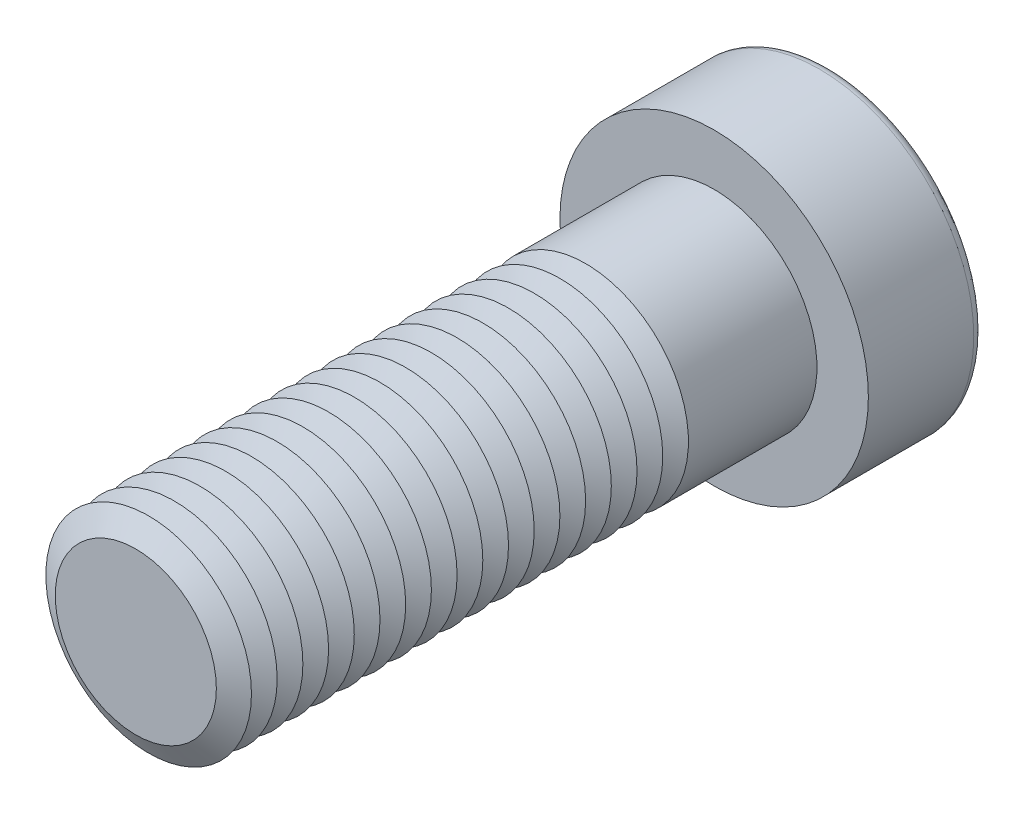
SolidWorks part; units mm, degrees
ref_plane "Front Plane" through (0, 0, 0) normal (0, 0, 1) x (1, 0, 0)
ref_plane "Top Plane" through (0, 0, 0) normal (0, 1, 0) x (1, 0, 0)
ref_plane "Right Plane" through (0, 0, 0) normal (1, 0, 0) x (0, 0, -1)
sketch "Sketch1" plane through (0, 0, 0) normal (0, 0, 1) x (1, 0, 0)
  circle A0 centre (0, 0) radius 8
  dimension "D1" = 16
extrude "Boss-Extrude1" add sketch "Sketch1" along normal blind 45
sketch "Sketch2" plane through (0, 0, 0) normal (0, 0, -1) x (-1, 0, 0)
  circle A0 centre (0, 0) radius 12
  dimension "D1" = 24
extrude "Boss-Extrude2" add sketch "Sketch2" along normal blind 9
sketch "Sketch3" plane through (0, 0, -9) normal (0, 0, -1) x (-1, 0, 0)
  line L1 (-3.4641, 6) -> (-6.9282, 0)
  line L2 (-6.9282, 0) -> (-3.4641, -6)
  line L3 (-3.4641, -6) -> (3.4641, -6)
  line L4 (3.4641, -6) -> (6.9282, 0)
  line L5 (6.9282, 0) -> (3.4641, 6)
  line L6 (3.4641, 6) -> (-3.4641, 6)
  circle A0 centre (0, 0) radius 6 construction
  dimension "D1" = 12
extrude "Cut-Extrude1" cut sketch "Sketch3" against normal blind 9
fillet "Fillet1" radius 0.8 1 edges at (-12, 0, -9)
sketch "Sketch4" plane through (0, 0, 0) normal (0, 0, -1) x (-1, 0, 0)
  line L0 (3.4641, -6) -> (6.9282, 0) construction
  circle A0 centre (0, 0) radius 6
extrude "Cut-Extrude2" cut sketch "Sketch4" against normal through all draft 60
sketch "Sketch5" plane through (0, 0, -9) normal (0, 0, -1) x (-1, 0, 0)
  circle A0 centre (0, 0) radius 6.9282
extrude "Cut-Extrude3" cut sketch "Sketch5" against normal through all draft 75
sketch "Sketch7" plane through (0, 0, 0) normal (1, 0, 0) x (0, 0, -1)
  line L25 (-45, 6.2679) -> (-44, 8)
  line L26 (-45, 8) -> (-45, -8) construction
  line L27 (-44, 8) -> (-46, 8)
  line L28 (-46, 8) -> (-45, 6.2679)
  line L29 (0, 8) -> (-45, 8) construction
  dimension "D1" = 2
revolve "Cut-Revolve1" cut sketch "Sketch7" angle 360 about axis through (0, 0, 45) along (0, 0, -1)
pattern_linear "LPattern1" count 18 spacing 2 along (0, 0, -1) of "Cut-Revolve1"
